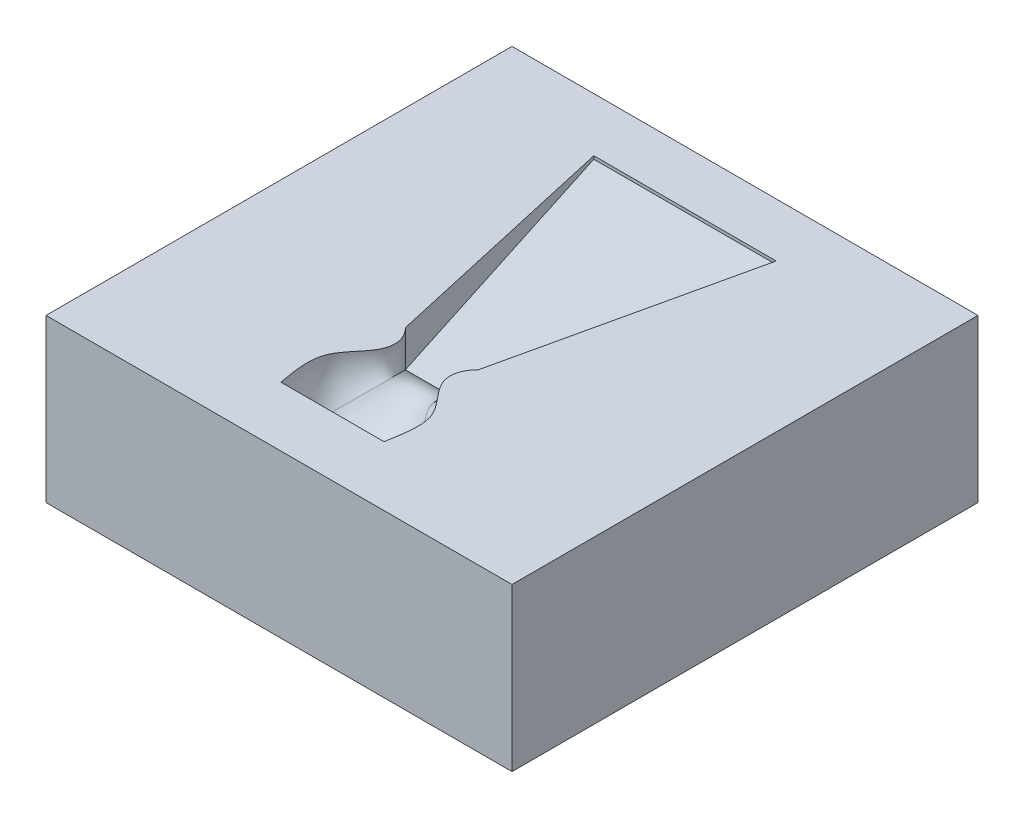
SolidWorks part; units mm, degrees
ref_plane "Alzado" through (0, 0, 0) normal (0, 0, 1) x (1, 0, 0)
ref_plane "Planta" through (0, 0, 0) normal (0, 1, 0) x (1, 0, 0)
ref_plane "Vista lateral" through (0, 0, 0) normal (1, 0, 0) x (0, 0, -1)
sketch "Croquis1" plane through (0, 0, 0) normal (0, 1, 0) x (1, 0, 0)
  line L1 (0, 0) -> (-115, 0)
  line L2 (0, 0) -> (0, 115)
  line L3 (0, 115) -> (-115, 115)
  line L4 (-115, 0) -> (-115, 115)
  dimension "D1" = 115
  dimension "D2" = 115
extrude "Saliente-Extruir1" add sketch "Croquis1" along normal blind 40
other "Cavidad1"
other "Cincelv1<1>@En_molde1"
